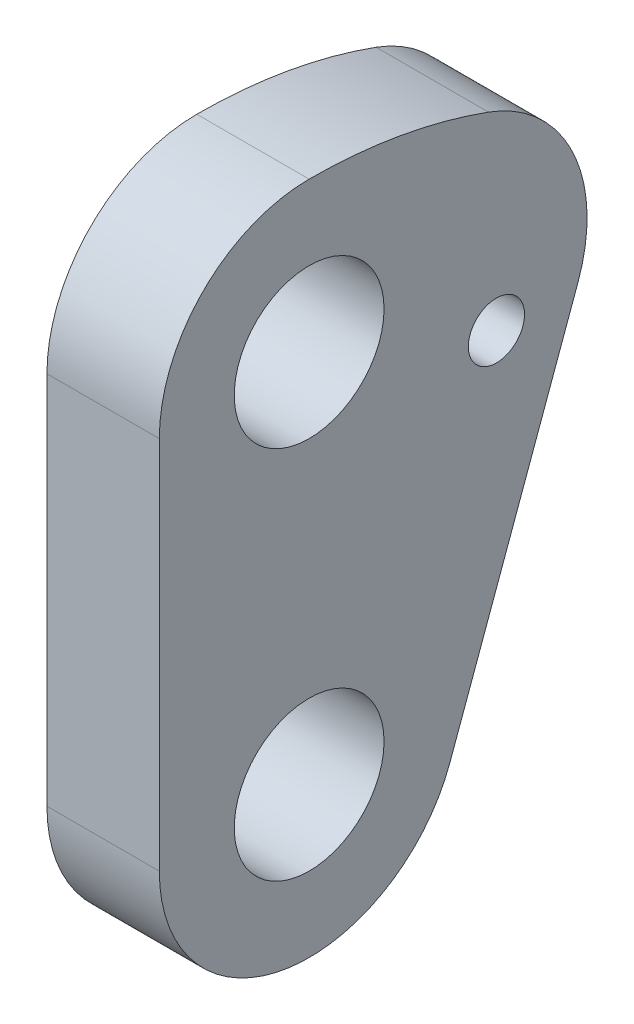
SolidWorks part; units mm, degrees
ref_plane "Front Plane" through (0, 0, 0) normal (0, 0, 1) x (1, 0, 0)
ref_plane "Top Plane" through (0, 0, 0) normal (0, 1, 0) x (1, 0, 0)
ref_plane "Right Plane" through (0, 0, 0) normal (1, 0, 0) x (0, 0, -1)
sketch "Sketch1" plane through (0, 0, 0) normal (1, 0, 0) x (0, 0, -1)
  line L0 (0, 0) -> (0, 14.2707) construction
  line L1 (0, 0) -> (5.2246, 14.3545) construction
  line L2 (-4, 10) -> (-4, 0)
  line L3 (3.7588, -1.3681) -> (7.179, 8.0288)
  circle A0 centre (0, 0) radius 2
  circle A1 centre (0, 10) radius 2
  arc A2 (-4, 0) -> (3.7588, -1.3681) centre (0, 0) ccw
  arc A3 (7.179, 8.0288) -> (4.7883, 13.1557) centre (3.4202, 9.3969) ccw
  arc A5 (0, 14) -> (4.7883, 13.1557) centre (0, 0) cw
  arc A6 (0, 14) -> (-4, 10) centre (0, 10) ccw
  dimension "D1" = 4
  dimension "D2" = 4
  dimension "D5" = 8
  dimension "D3" = 10
  dimension "D4" = 20
  dimension "D8" = 10
extrude "Boss-Extrude1" add sketch "Sketch1" along normal blind 3
sketch "Sketch2" plane through (3, 0, 0) normal (1, 0, 0) x (0, 0, -1)
  circle A0 centre (5, 8) radius 0.75
  dimension "D1" = 1.5
  dimension "D2" = 8
  dimension "D3" = 5
extrude "Cut-Extrude1" cut sketch "Sketch2" against normal through all
